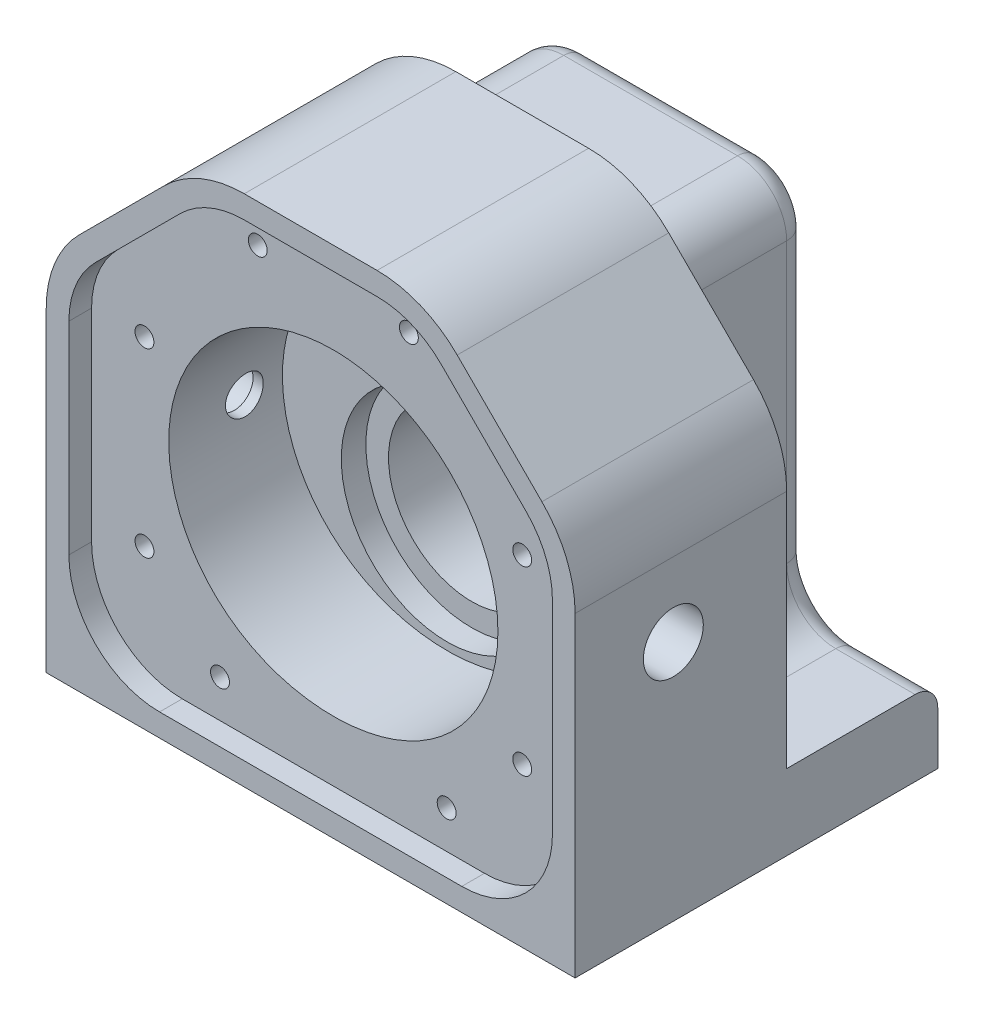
SolidWorks part; units mm, degrees
ref_plane "Face" through (0, 0, 0) normal (0, 0, 1) x (1, 0, 0)
ref_plane "Dessus" through (0, 0, 0) normal (0, 1, 0) x (1, 0, 0)
ref_plane "Droite" through (0, 0, 0) normal (1, 0, 0) x (0, 0, -1)
sketch "Esquisse1" plane through (0, 0, 0) normal (0, 0, 1) x (1, 0, 0)
  line L1 (-35, -32) -> (35, -32)
  line L2 (-35, -32) -> (-35, 38)
  line L3 (-35, 38) -> (35, 38)
  line L4 (35, -32) -> (35, 38)
  dimension "D1" = 70
  dimension "D2" = 70
  dimension "D3" = 32
  dimension "D4" = 35
extrude "brut 70 x 70 x 50" add sketch "Esquisse1" along normal blind 50
sketch "Esquisse 1" plane through (0, 0, 0) normal (0, 0, -1) x (-1, 0, 0)
  line L4 (35, -32) -> (35, 38)
  line L5 (35, 38) -> (-35, 38)
  line L6 (-35, 38) -> (-35, -32)
  line L7 (-35, -32) -> (35, -32)
  line L8 (35, -32) -> (35, 38)
  line L9 (35, 38) -> (-35, 38)
  line L10 (-35, 38) -> (-35, -32)
  line L11 (-35, -32) -> (35, -32)
  dimension "D1" = 0
extrude "Surfaçage ph 10" cut sketch "Esquisse 1" against normal blind 1
sketch "Esquisse 2" plane through (0, 0, 1) normal (0, 0, -1) x (-1, 0, 0)
  line L0 (-35, -22) -> (-24.5, -22)
  line L1 (-18, -15.5) -> (-18, 21.5)
  line L2 (-11.5, 28) -> (11.5, 28)
  line L3 (18, 21.5) -> (18, -15.5)
  line L4 (-35, -32) -> (35, -32)
  line L5 (35, -32) -> (35, 38)
  line L6 (35, 38) -> (-35, 38)
  line L7 (-35, 38) -> (-35, -32)
  line L8 (-35, -32) -> (35, -32)
  line L9 (35, -32) -> (35, -22)
  line L11 (-35, -22) -> (-35, -32)
  line L12 (24.5, -22) -> (35, -22)
  arc A0 (-24.5, -22) -> (-18, -15.5) centre (-24.5, -15.5) ccw
  arc A1 (-18, 21.5) -> (-11.5, 28) centre (-11.5, 21.5) cw
  arc A2 (18, 21.5) -> (11.5, 28) centre (11.5, 21.5) ccw
  arc A3 (18, -15.5) -> (24.5, -22) centre (24.5, -15.5) ccw
  point P15 (-18, 28)
  point P18 (18, 28)
  dimension "D6" = 6.5
  dimension "D2" = 10
  dimension "D3" = 60
  dimension "D4" = 18
  dimension "D5" = 36
  dimension "D1" = 0
extrude "Contournage ph 10" cut sketch "Esquisse 2" against normal blind 20 flip side to cut
fillet "Arrondi ph 10" radius 3 9 edges at (29.75, -22, 1) (19.9038, -20.0962, 1) (18, 3, 1) (16.0962, 26.0962, 1) (0, 28, 1) (-16.0962, 26.0962, 1) (-18, 3, 1) (-19.9038, -20.0962, 1) (-29.75, -22, 1)
sketch "Esquisse 3" plane through (0, 0, 50) normal (0, 0, 1) x (1, 0, 0)
  line L4 (-35, 38) -> (-35, -32)
  line L5 (-35, -32) -> (35, -32)
  line L6 (35, -32) -> (35, 38)
  line L7 (35, 38) -> (-35, 38)
  line L8 (-35, 38) -> (-35, -32)
  line L9 (-35, -32) -> (35, -32)
  line L10 (35, -32) -> (35, 38)
  line L11 (35, 38) -> (-35, 38)
  dimension "D1" = 0
extrude "Surfaçage ph 20" cut sketch "Esquisse 3" against normal offset from surface (1 mm away) 48
sketch "Esquisse 4" plane through (0, 0, 49) normal (0, 0, 1) x (1, 0, 0)
  line L0 (-35, -32) -> (35, -32) construction
  line L1 (19.3934, 31.6066) -> (30.6066, 20.3934)
  line L2 (-19.3934, 31.6066) -> (-30.6066, 20.3934)
  line L3 (-35, 38) -> (-35, -32) construction
  line L4 (35, 38) -> (-35, 38)
  line L5 (-35, 38) -> (-35, -32)
  line L6 (-35, -32) -> (35, -32)
  line L7 (35, -32) -> (35, 38)
  line L9 (-35, 9.7868) -> (-35, -32)
  line L10 (-35, -32) -> (35, -32)
  line L11 (35, -32) -> (35, 9.7868)
  line L14 (-8.7868, 36) -> (8.7868, 36)
  arc A0 (-19.3934, 31.6066) -> (-8.7868, 36) centre (-8.7868, 21) cw
  arc A1 (-30.6066, 20.3934) -> (-35, 9.7868) centre (-20, 9.7868) ccw
  arc A2 (30.6066, 20.3934) -> (35, 9.7868) centre (20, 9.7868) cw
  arc A3 (19.3934, 31.6066) -> (8.7868, 36) centre (8.7868, 21) ccw
  point P14 (-15, 36)
  point P19 (15, 36)
  dimension "D6" = 20
  dimension "D7" = 15
  dimension "D8" = 15
  dimension "D2" = 135
  dimension "D3" = 135
  dimension "D4" = 68
  dimension "D5" = 30
  dimension "D1" = 0
extrude "Contour ph 20" cut sketch "Esquisse 4" against normal blind 30 flip side to cut
sketch "Esquisse 5" plane through (0, 0, 49) normal (0, 0, 1) x (1, 0, 0)
  circle A0 centre (0, -6) radius 8.25
  dimension "D1" = 16.5
  dimension "D2" = 6
extrude "Perçage Ø16,5  ph 20" cut sketch "Esquisse 5" against normal through all
sketch "Positions points" plane through (0, 0, 49) normal (0, 0, 1) x (1, 0, 0)
  point P0 (0, 21)
  point P1 (2.351, 20.875)
  point P2 (4.673, 20.5)
  point P3 (6.935, 19.883)
  point P5 (11.173, 17.961)
  point P6 (9.111, 19.032)
  point P7 (13.098, 16.687)
  point P8 (14.864, 15.228)
  point P9 (16.453, 13.608)
  point P10 (17.849, 11.849)
  point P11 (19.041, 9.978)
  point P12 (20.021, 8.019)
  point P13 (20.785, 6)
  point P14 (21.331, 3.947)
  point P15 (21.662, 1.884)
  point P16 (21.784, -0.163)
  point P17 (21.707, -2.172)
  point P18 (21.441, -4.124)
  point P19 (20.399, -7.785)
  point P20 (21, -6)
  point P21 (19.655, -9.466)
  point P22 (18.784, -11.033)
  point P23 (17.805, -12.481)
  point P24 (16.734, -13.803)
  point P25 (15.588, -15)
  point P26 (14.383, -16.071)
  point P27 (13.133, -17.019)
  point P28 (11.849, -17.849)
  point P29 (10.544, -18.566)
  point P30 (9.226, -19.176)
  point P31 (7.902, -19.687)
  point P32 (6.577, -20.104)
  point P33 (5.254, -20.435)
  point P34 (3.935, -20.686)
  point P35 (2.621, -20.862)
  point P36 (1.309, -20.966)
  point P37 (0, -21)
  point P40 (-1.309, -20.966)
  point P41 (-2.621, -20.862)
  point P42 (-3.935, -20.686)
  point P43 (-5.254, -20.435)
  point P44 (-6.577, -20.104)
  point P45 (-7.902, -19.687)
  point P46 (-9.226, -19.176)
  point P47 (-10.544, -18.566)
  point P48 (-11.849, -17.849)
  point P49 (-13.133, -17.019)
  point P50 (-14.383, -16.071)
  point P51 (-15.588, -15)
  point P52 (-16.734, -13.803)
  point P53 (-17.805, -12.481)
  point P54 (-18.784, -11.033)
  point P55 (-19.655, -9.466)
  point P56 (-21, -6)
  point P57 (-20.399, -7.785)
  point P58 (-21.441, -4.124)
  point P59 (-21.707, -2.172)
  point P60 (-21.784, -0.163)
  point P61 (-21.662, 1.884)
  point P62 (-21.331, 3.947)
  point P63 (-20.785, 6)
  point P64 (-20.021, 8.019)
  point P65 (-19.041, 9.978)
  point P66 (-17.849, 11.849)
  point P67 (-16.453, 13.608)
  point P68 (-14.864, 15.228)
  point P69 (-13.098, 16.687)
  point P70 (-9.111, 19.032)
  point P71 (-11.173, 17.961)
  point P72 (-6.935, 19.883)
  point P73 (-4.673, 20.5)
  point P74 (-2.351, 20.875)
curve "Courbe2"
sketch "Esquisse 6" plane through (0, 0, 49) normal (0, 0, 1) x (1, 0, 0)
  line L18 (8.7868, 33) -> (-8.7868, 33)
  line L19 (28.4853, 18.2721) -> (17.2721, 29.4853)
  line L20 (32, -29) -> (32, 9.7868)
  line L21 (-32, -29) -> (32, -29)
  line L22 (-32, 9.7868) -> (-32, -29)
  line L23 (-17.2721, 29.4853) -> (-28.4853, 18.2721)
  line L24 (8.7868, 33) -> (-8.7868, 33)
  line L25 (28.4853, 18.2721) -> (17.2721, 29.4853)
  line L26 (32, -17) -> (32, 9.7868)
  line L27 (-20, -29) -> (20, -29)
  line L28 (-32, 9.7868) -> (-32, -17)
  line L29 (-17.2721, 29.4853) -> (-28.4853, 18.2721)
  arc A8 (-20, -29) -> (-32, -17) centre (-20, -17) cw
  arc A9 (32, -17) -> (20, -29) centre (20, -17) cw
  arc A12 (-8.7868, 33) -> (-17.2721, 29.4853) centre (-8.7868, 21) ccw
  arc A13 (17.2721, 29.4853) -> (8.7868, 33) centre (8.7868, 21) ccw
  arc A14 (32, 9.7868) -> (28.4853, 18.2721) centre (20, 9.7868) ccw
  arc A15 (-28.4853, 18.2721) -> (-32, 9.7868) centre (-20, 9.7868) ccw
  arc A16 (-8.7868, 33) -> (-17.2721, 29.4853) centre (-8.7868, 21) ccw
  arc A17 (17.2721, 29.4853) -> (8.7868, 33) centre (8.7868, 21) ccw
  arc A18 (32, 9.7868) -> (28.4853, 18.2721) centre (20, 9.7868) ccw
  arc A19 (-28.4853, 18.2721) -> (-32, 9.7868) centre (-20, 9.7868) ccw
  dimension "D1" = 3
  dimension "D2" = 12
extrude "Logement pléxiglass ph 20" cut sketch "Esquisse 6" against normal blind 3
sketch "Esquisse 7" plane through (0, 0, 46) normal (0, 0, 1) x (1, 0, 0)
  point P0 (0, 21)
  dimension "D1" = 0
extrude "Concoïde ph 20" cut sketch "Esquisse 7" against normal blind 15.05
sketch "Esquisse 8" plane through (0, 0, 30.95) normal (0, 0, 1) x (1, 0, 0)
  circle A0 centre (0, -6) radius 14
  dimension "D1" = 28
extrude "Logement colerette ph 20" cut sketch "Esquisse 8" against normal blind 3.25
sketch "Esquisse 9" plane through (0, 0, 27.7) normal (0, 0, 1) x (1, 0, 0)
  circle A0 centre (0, -6) radius 11
  dimension "D1" = 22
extrude "Alésage bague ph20" cut sketch "Esquisse 9" against normal blind 23
sketch "Esquisse 10" plane through (0, 0, 46) normal (0, 0, 1) x (1, 0, 0)
  circle A0 centre (0, 0) radius 28.5
  circle A1 centre (0, 0) radius 25
  dimension "D1" = 57
  dimension "D2" = 50
extrude "Logement joint ph20" [suppressed] cut sketch "Esquisse 10" against normal blind 3.3
hole_wizard "Trou taraudé M3x0.5 ph20" positions "Esquisse 11" profile "Esquisse 12" tap size "M3x0.5" standard "Ansi Métrique"
sketch "Esquisse 11" plane through (0, 0, 46) normal (0, 0, 1) x (1, 0, 0)
  point P0 (-15, -24)
  point P1 (-25, -14)
  point P2 (-25, 10)
  point P3 (-10, 28)
  point P4 (10, 28)
  point P5 (25, 10)
  point P6 (25, -14)
  point P7 (15, -24)
  dimension "D1" = 25
  dimension "D2" = 10
  dimension "D3" = 28
  dimension "D4" = 10
  dimension "D5" = 20
  dimension "D6" = 50
  dimension "D7" = 14
  dimension "D8" = 24
  dimension "D9" = 15
  dimension "D10" = 30
sketch "Esquisse 12" plane through (-15, -24, 46) normal (1, 0, 0) x (0, -1, 0)
  line L0 (0, 0) -> (0, 9.2511)
  line L1 (0, 9.2511) -> (1.25, 8.5)
  line L2 (1.25, 8.5) -> (1.25, 0)
  line L5 (1.25, 0) -> (0, 0)
  line L10 (0, 9.2511) -> (-1.25, 8.5) construction
  line L11 (0, -6.35) -> (0, 107.95) construction
  dimension "Diamètre du perçage" = 2.5
  dimension "Profondeur du perçage" = 8.5
  dimension "Angle de pointe" = 118
sketch "Esquisse 13" plane through (35, 0, 0) normal (1, 0, 0) x (0, 0, -1)
  line L0 (-49, -32) -> (-49, 9.7868) construction
  circle A0 centre (-36, 0) radius 2.5
  dimension "D2" = 5
  dimension "D1" = 13
extrude "Percage Ø5 ph 30" cut sketch "Esquisse 13" against normal through all
hole_wizard "Trou taraudé 3/8-16 ph 30" positions "Esquisse 14" profile "Esquisse 15" tap size "3/8-16" standard "Ansi Pouce"
sketch "Esquisse 14" plane through (-35, 0, 0) normal (-1, 0, 0) x (0, 0, 1)
  circle A0 centre (36, 0) radius 2.5 construction
  point P0 (36, 0)
sketch "Esquisse 15" plane through (-35, 0, 36) normal (0, 1, 0) x (0, 0, 1)
  line L0 (0, 0) -> (0, 13.3847)
  line L1 (0, 13.3847) -> (3.9687, 11)
  line L2 (3.9687, 11) -> (3.9687, 0)
  line L5 (3.9687, 0) -> (0, 0)
  line L10 (0, 13.3847) -> (-3.9688, 11) construction
  line L11 (0, -6.35) -> (0, 107.95) construction
  dimension "Diamètre du perçage" = 7.9375
  dimension "Profondeur du perçage" = 11
  dimension "Angle de pointe" = 118
hole_wizard "Trou taraudé 3/8-16   ph 30" positions "Esquisse 16" profile "Esquisse 17" tap size "3/8-16" standard "Ansi Pouce"
sketch "Esquisse 16" plane through (35, 0, 0) normal (1, 0, 0) x (0, 0, -1)
  circle A0 centre (-36, 0) radius 2.5 construction
  point P0 (-36, 0)
sketch "Esquisse 17" plane through (35, 0, 36) normal (0, 1, 0) x (0, 0, -1)
  line L0 (0, 0) -> (0, 13.3847)
  line L1 (0, 13.3847) -> (3.9687, 11)
  line L2 (3.9687, 11) -> (3.9687, 0)
  line L5 (3.9687, 0) -> (0, 0)
  line L10 (0, 13.3847) -> (-3.9688, 11) construction
  line L11 (0, -6.35) -> (0, 107.95) construction
  dimension "Diamètre du perçage" = 7.9375
  dimension "Profondeur du perçage" = 11
  dimension "Angle de pointe" = 118
